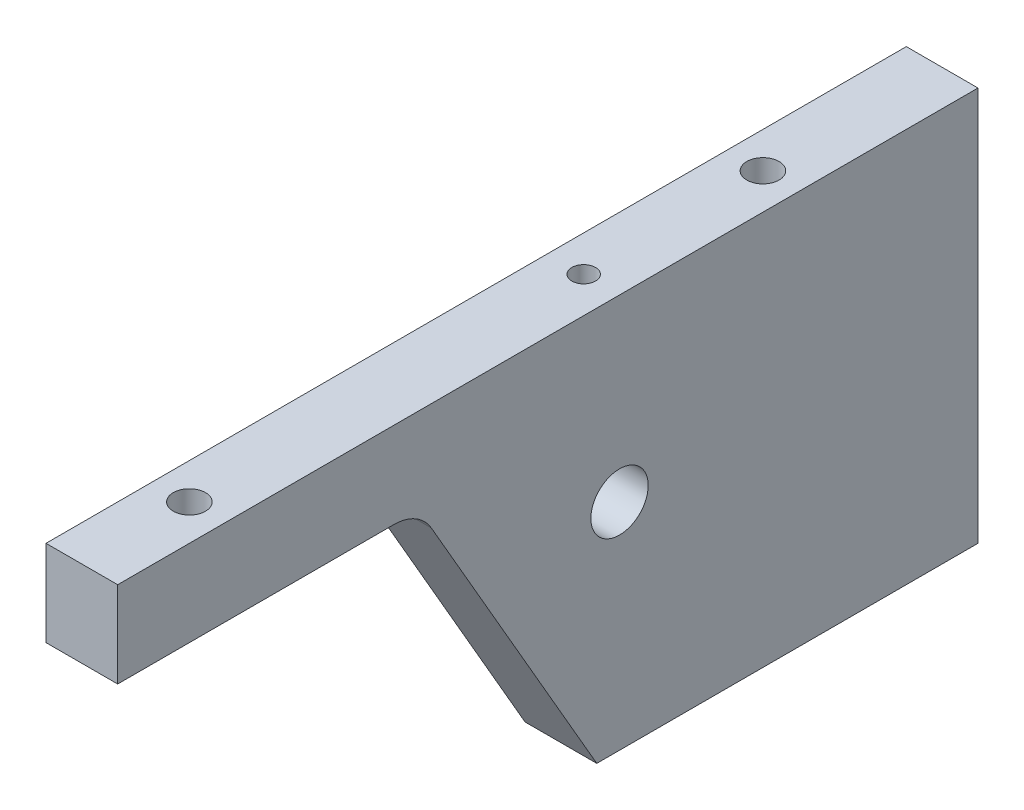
SolidWorks part; units mm, degrees
ref_plane "Front Plane" through (0, 0, 0) normal (0, 0, 1) x (1, 0, 0)
ref_plane "Top Plane" through (0, 0, 0) normal (0, 1, 0) x (1, 0, 0)
ref_plane "Right Plane" through (0, 0, 0) normal (1, 0, 0) x (0, 0, -1)
sketch "Sketch1" plane through (0, 0, 0) normal (1, 0, 0) x (0, 0, -1)
  line L0 (0, 0) -> (0, -55)
  line L1 (0, -55) -> (-53.1739, -55)
  line L2 (-120, 0) -> (-120, -12)
  line L3 (-120, -12) -> (-78, -12)
  line L4 (-120, 0) -> (0, 0)
  line L5 (-78, -12) -> (-53.1739, -55)
  dimension "D1" = 55
  dimension "D2" = 120
  dimension "D3" = 12
  dimension "D4" = 120
  dimension "D5" = 42
extrude "Boss-Extrude1" add sketch "Sketch1" along normal mid plane 10
hole_wizard "M4x0.7 Tapped Hole4" positions "Sketch3" profile "Sketch2" tap size "M4x0.7" standard "ANSI Metric"
sketch "Sketch3" plane through (0, 0, 0) normal (0, 0, -1) x (-1, 0, 0)
  point P0 (0, -10)
  point P3 (0, -27.5)
  point P6 (0, -45)
sketch "Sketch2" plane through (0, -10, 0) normal (1, 0, 0) x (0, 1, 0)
  line L0 (0, 0) -> (0, 11.0914)
  line L1 (0, 11.0914) -> (1.65, 10.1)
  line L2 (1.65, 10.1) -> (1.65, 0)
  line L5 (1.65, 0) -> (0, 0)
  line L10 (0, 11.0914) -> (-1.65, 10.1) construction
  line L11 (0, -6.35) -> (0, 107.95) construction
  dimension "Tap Drill Dia." = 3.3
  dimension "Tap Drill Depth" = 10.1
  dimension "Drill Angle" = 118
fillet "Fillet1" radius 6 1 edges at (0, -12, 78)
sketch "Sketch8" plane through (5, 0, 0) normal (1, 0, 0) x (0, 0, -1)
  line L0 (0, 0) -> (-120, 0) construction
  line L1 (0, -55) -> (0, 0) construction
  circle A0 centre (-50, -25) radius 4
  dimension "D1" = 8
  dimension "D2" = 25
  dimension "D3" = 50
extrude "Cut-Extrude1" cut sketch "Sketch8" against normal up to surface (10 mm away)
hole_wizard "M4x0.7 Tapped Hole3" positions "Sketch10" profile "Sketch9" tap size "M4x0.7" standard "ANSI Metric"
sketch "Sketch10" plane through (0, 0, 0) normal (0, 1, 0) x (1, 0, 0)
  line L0 (-5, -50) -> (5, -50) construction
  line L1 (5, 0) -> (5, -120) construction
  point P0 (0, -50)
  dimension "D1" = 5
sketch "Sketch9" plane through (0, 0, 50) normal (1, 0, 0) x (0, 0, 1)
  line L0 (0, 0) -> (0, 21)
  line L1 (0, 21) -> (1.65, 21)
  line L2 (1.65, 21) -> (1.65, 0)
  line L5 (1.65, 0) -> (0, 0)
  line L11 (0, -6.35) -> (0, 107.95) construction
  dimension "Thru Tap Drill Dia." = 3.3
  dimension "Thru Tap Drill Depth" = 21
hole_wizard "CBORE for M4 SHCS1" positions "Sketch13" profile "Sketch11" counterbore size "M4" standard "ANSI Metric"
sketch "Sketch13" plane through (0, -55, 0) normal (0, -1, 0) x (-1, 0, 0)
  line L0 (-5, 0) -> (5, 0) construction
  line L1 (-5, -53.1739) -> (-5, 0) construction
  point P0 (0, -25)
  dimension "D1" = 25
  dimension "D2" = 5
sketch "Sketch11" plane through (0, -55, 25) normal (1, 0, 0) x (0, 0, -1)
  line L0 (0, 0) -> (0, 55)
  line L1 (0, 55) -> (2.25, 55)
  line L3 (2.25, 55) -> (2.25, 30)
  line L4 (2.25, 30) -> (4, 30)
  line L5 (4, 30) -> (4, 0)
  line L7 (4, 0) -> (0, 0)
  line L11 (0, -6.35) -> (0, 107.95) construction
  dimension "Thru Hole Dia." = 4.5
  dimension "Thru Hole Depth" = 55
  dimension "C'Bore Dia." = 8
  dimension "C'Bore Depth" = 30
hole_wizard "CBORE for M4 SHCS2" positions "Sketch15" profile "Sketch14" counterbore size "M4" standard "ANSI Metric"
sketch "Sketch15" plane through (0, -12, 0) normal (0, -1, 0) x (-1, 0, 0)
  line L0 (-5, -120) -> (5, -120) construction
  line L1 (-5, -120) -> (-5, -81.4641) construction
  point P0 (0, -105)
  dimension "D1" = 15
  dimension "D2" = 5
sketch "Sketch14" plane through (0, -12, 105) normal (1, 0, 0) x (0, 0, -1)
  line L0 (0, 0) -> (0, 12)
  line L1 (0, 12) -> (2.25, 12)
  line L3 (2.25, 12) -> (2.25, 4)
  line L4 (2.25, 4) -> (4, 4)
  line L5 (4, 4) -> (4, 0)
  line L7 (4, 0) -> (0, 0)
  line L11 (0, -6.35) -> (0, 107.95) construction
  dimension "Thru Hole Dia." = 4.5
  dimension "Thru Hole Depth" = 12
  dimension "C'Bore Dia." = 8
  dimension "C'Bore Depth" = 4
